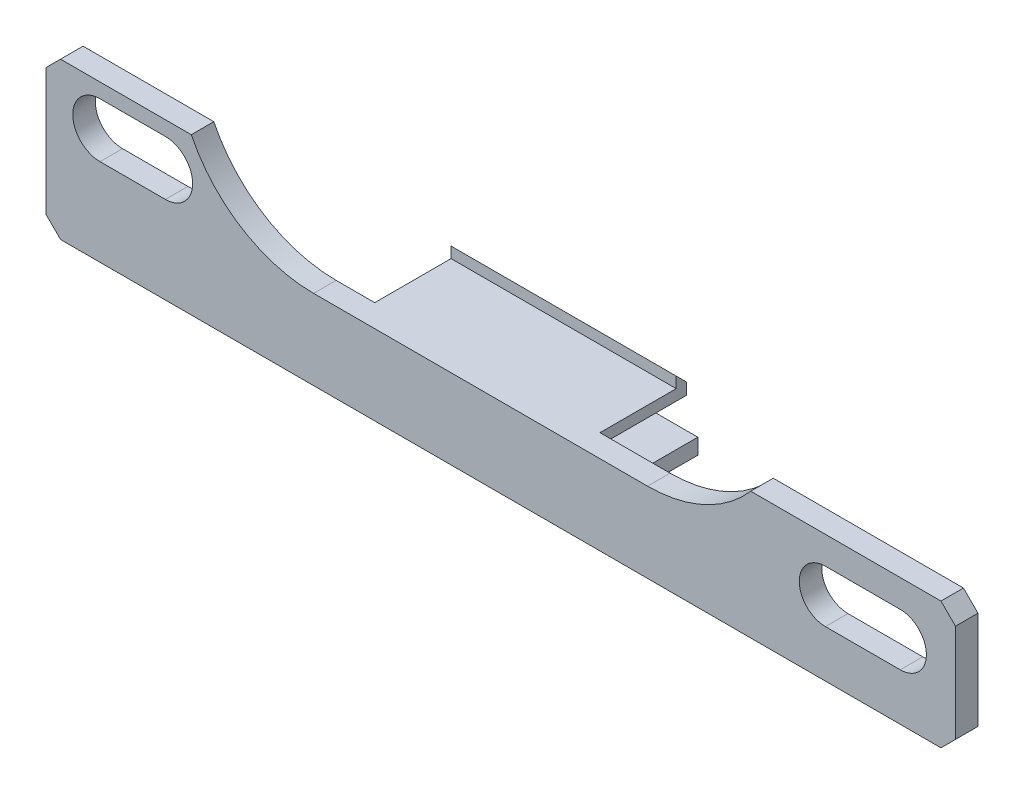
SolidWorks part; units mm, degrees
ref_plane "Front Plane" through (0, 0, 0) normal (0, 0, 1) x (1, 0, 0)
ref_plane "Top Plane" through (0, 0, 0) normal (0, 1, 0) x (1, 0, 0)
ref_plane "Right Plane" through (0, 0, 0) normal (1, 0, 0) x (0, 0, -1)
sketch "Sketch1" plane through (0, 0, 0) normal (0, 0, 1) x (1, 0, 0)
  line L0 (0, 0) -> (0, 10.922)
  line L1 (0, 10.922) -> (10.16, 10.922)
  line L2 (0, 0) -> (63.5953, 0)
  line L3 (63.5953, 0) -> (63.5953, 8.89)
  line L4 (63.5953, 8.89) -> (49.276, 8.89)
  line L5 (18.7134, 5.588) -> (42.0649, 5.588)
  line L6 (0, 86.3263) -> (21.4122, 86.3263) construction
  line L7 (21.4122, 86.3263) -> (37.1602, 86.3263) construction
  line L8 (3.776, 8.001) -> (8.348, 8.001) construction
  line L9 (3.776, 9.906) -> (8.348, 9.906)
  line L10 (3.776, 6.096) -> (8.348, 6.096)
  line L11 (54.4998, 5.1308) -> (59.7322, 5.1308) construction
  line L12 (54.4998, 6.9596) -> (59.7322, 6.9596)
  line L13 (54.4998, 3.302) -> (59.7322, 3.302)
  arc A0 (10.16, 10.922) -> (18.7134, 5.588) centre (18.7134, 15.113) ccw
  arc A1 (49.276, 8.89) -> (42.0649, 5.588) centre (42.0649, 15.113) cw
  arc A2 (3.776, 9.906) -> (3.776, 6.096) centre (3.776, 8.001) ccw
  arc A3 (8.348, 6.096) -> (8.348, 9.906) centre (8.348, 8.001) ccw
  arc A4 (54.4998, 6.9596) -> (54.4998, 3.302) centre (54.4998, 5.1308) ccw
  arc A5 (59.7322, 3.302) -> (59.7322, 6.9596) centre (59.7322, 5.1308) ccw
  point P12 (6.062, 8.001)
  point P21 (57.116, 5.1308)
  point P28 (1.871, 8.001)
  point P29 (52.671, 5.1308)
  point P30 (61.561, 5.1308)
  dimension "D1" = 9.525
  dimension "D2" = 9.525
  dimension "D16" = 1.8288
  dimension "D17" = 5.2324
  dimension "D3" = 5.588
  dimension "D4" = 10.922
  dimension "D5" = 10.16
  dimension "D6" = 49.276
  dimension "D7" = 8.89
  dimension "D8" = 21.4122
  dimension "D9" = 15.748
  dimension "D10" = 6.096
  dimension "D11" = 50.8
  dimension "D12" = 8.89
  dimension "D13" = 3.6576
  dimension "D14" = 3.302
  dimension "D15" = 5.1308
  dimension "D18" = 3.81
  dimension "D19" = 4.572
extrude "Boss-Extrude1" add sketch "Sketch1" against normal blind 1.5748
sketch "Sketch2" plane through (0, 0, 0) normal (0, 0, 1) x (1, 0, 0)
  line L0 (63.5953, 0) -> (63.5953, 8.89) construction
  line L1 (20.6871, 1.6002) -> (37.9591, 1.6002)
  line L2 (20.6871, 1.6002) -> (20.6871, 2.6924)
  line L3 (20.6871, 2.6924) -> (37.9591, 2.6924)
  line L4 (37.9591, 1.6002) -> (37.9591, 2.6924)
  line L5 (0, 0) -> (63.5953, 0) construction
  dimension "D1" = 1.0922
  dimension "D2" = 17.272
  dimension "D3" = 42.9082
  dimension "D4" = 1.6002
extrude "Boss-Extrude2" add sketch "Sketch2" against normal blind 7.62
sketch "Sketch3" plane through (0, 0, 0) normal (-1, 0, 0) x (0, 0, 1)
  line L0 (-1.5748, 4.826) -> (-7.62, 4.826)
  line L1 (0, 10.922) -> (0, 0) construction
  line L2 (-1.5748, 4.826) -> (-1.5748, 5.588)
  line L3 (-1.5748, 10.922) -> (-1.5748, 0) construction
  line L4 (-1.5748, 5.588) -> (-6.9088, 5.588)
  line L5 (-6.9088, 5.588) -> (-6.9088, 6.35)
  line L7 (-7.62, 5.6388) -> (-7.62, 4.826)
  line L8 (-6.9088, 6.35) -> (-7.62, 5.6388)
  line L9 (-1.5748, 5.588) -> (0, 5.588) construction
  dimension "D1" = 7.62
  dimension "D2" = 0.762
  dimension "D3" = 5.334
  dimension "D5" = 45
extrude "Boss-Extrude3" add sketch "Sketch3" against normal blind 15.748 from offset 21.4122
chamfer "Chamfer1" distance 1.016 angle 45 4 edges at (63.5953, 0, -0.7874) (63.5953, 8.89, -0.7874) (0, 0, -0.7874) (0, 10.922, -0.7874)
ref_plane "Plane ctr" through (31.7977, 0, 0) normal (1, 0, 0) x (0, 0, -1)
